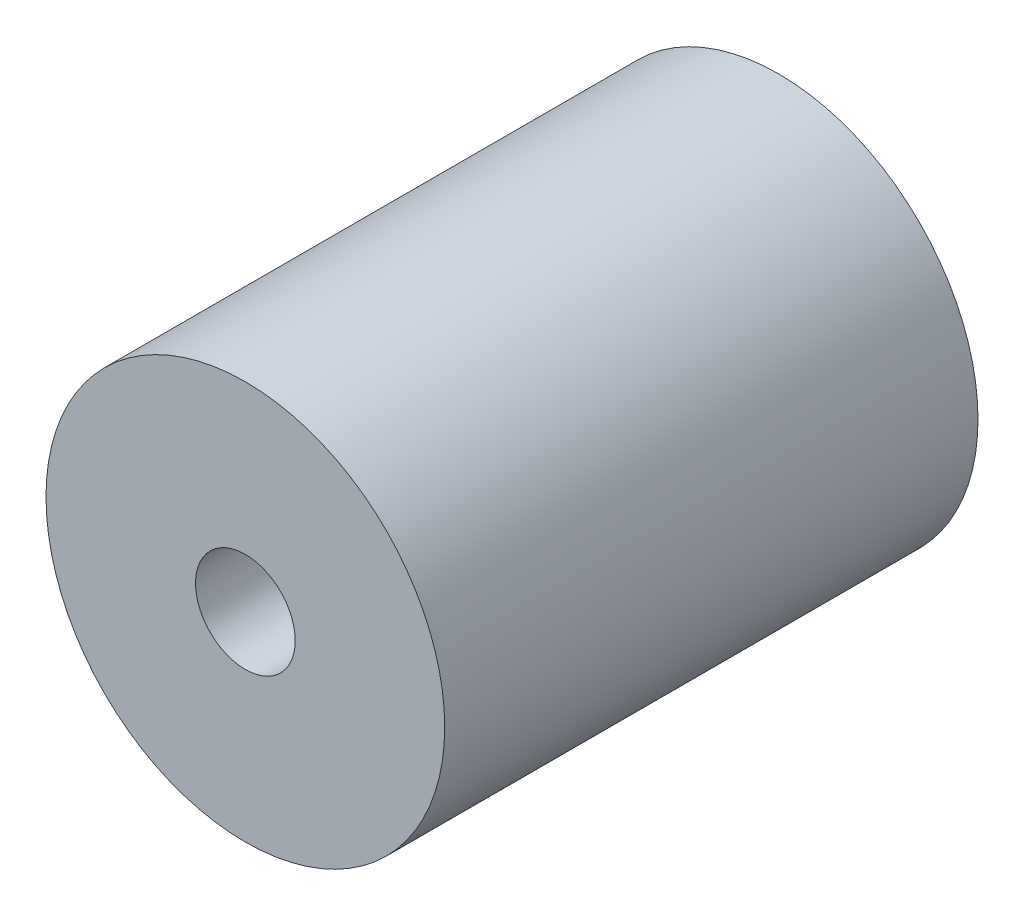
SolidWorks part; units mm, degrees
ref_plane "Front Plane" through (0, 0, 0) normal (0, 0, 1) x (1, 0, 0)
ref_plane "Top Plane" through (0, 0, 0) normal (0, 1, 0) x (1, 0, 0)
ref_plane "Right Plane" through (0, 0, 0) normal (1, 0, 0) x (0, 0, -1)
sketch "Sketch1" plane through (0, 0, 0) normal (0, 0, 1) x (1, 0, 0)
  circle A0 centre (0, 0) radius 4
  circle A1 centre (0, 0) radius 1
  dimension "D1" = 8
  dimension "D2" = 2
extrude "Boss-Extrude2" add sketch "Sketch1" along normal blind 10.7
